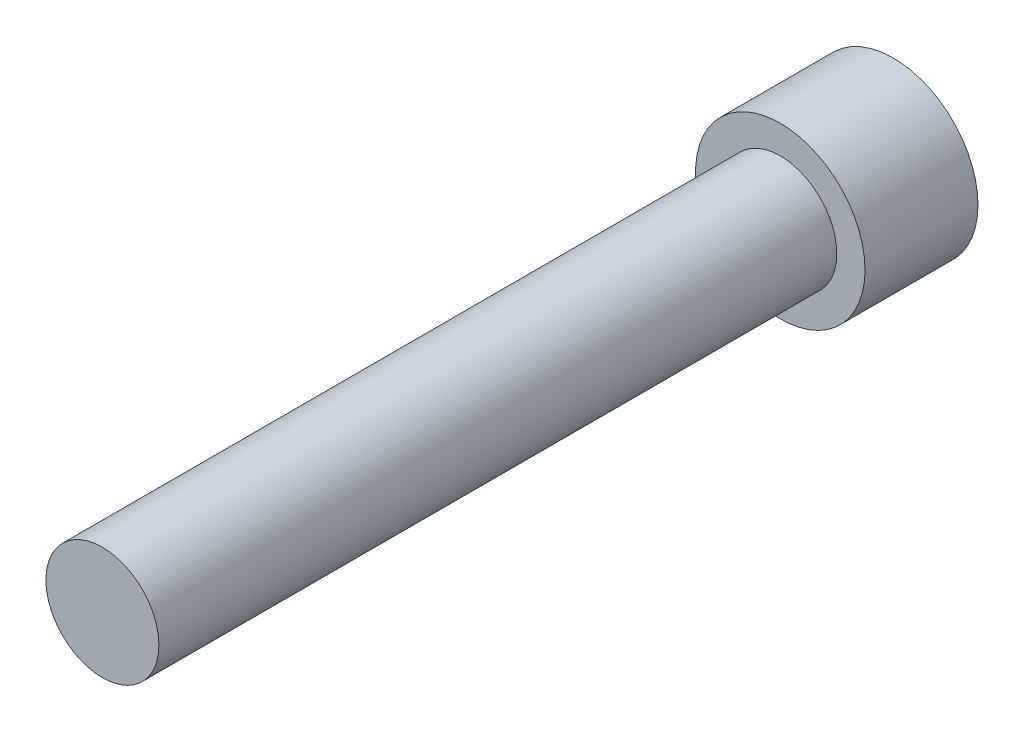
SolidWorks part; units mm, degrees
ref_plane "Front Plane" through (0, 0, 0) normal (0, 0, 1) x (1, 0, 0)
ref_plane "Top Plane" through (0, 0, 0) normal (0, 1, 0) x (1, 0, 0)
ref_plane "Right Plane" through (0, 0, 0) normal (1, 0, 0) x (0, 0, -1)
sketch "Sketch6" plane through (0, 0, 0) normal (1, 0, 0) x (0, 0, -1)
  line L0 (-38.1, 0) -> (22.525, 0) construction
  line L1 (5.2388, 0) -> (-5.2388, 0) construction
  line L2 (-38.1, 0) -> (-38.1, -3.175)
  line L3 (-38.1, -3.175) -> (0, -3.175)
  line L4 (0, 5.2388) -> (0, -5.2388) construction
  line L5 (0, -3.175) -> (0, -4.7625)
  line L6 (0, -4.7625) -> (6.35, -4.7625)
  line L7 (6.35, -4.7625) -> (6.35, 0)
  line L8 (6.35, 0) -> (-38.1, 0)
  dimension "L" = 38.1
  dimension "H" = 6.35
  dimension "A" = 9.525
  dimension "D" = 6.35
revolve "Revolve1" add sketch "Sketch6" angle 360 about L0
sketch "Sketch7" plane through (0, 0, -6.35) normal (0, 0, -1) x (-1, 0, 0)
  line L2 (-2.3876, 1.3785) -> (-2.3876, -1.3785)
  line L4 (-2.3876, -1.3785) -> (0, -2.757)
  line L5 (0, -2.757) -> (2.3876, -1.3785)
  line L6 (2.3876, -1.3785) -> (2.3876, 1.3785)
  line L7 (2.3876, 1.3785) -> (0, 2.757)
  line L8 (0, 2.757) -> (-2.3876, 1.3785)
  circle A0 centre (0, 0) radius 2.3876 construction
  dimension "J" = 4.7752
extrude "HEX" cut sketch "Sketch7" against normal blind 3.556
